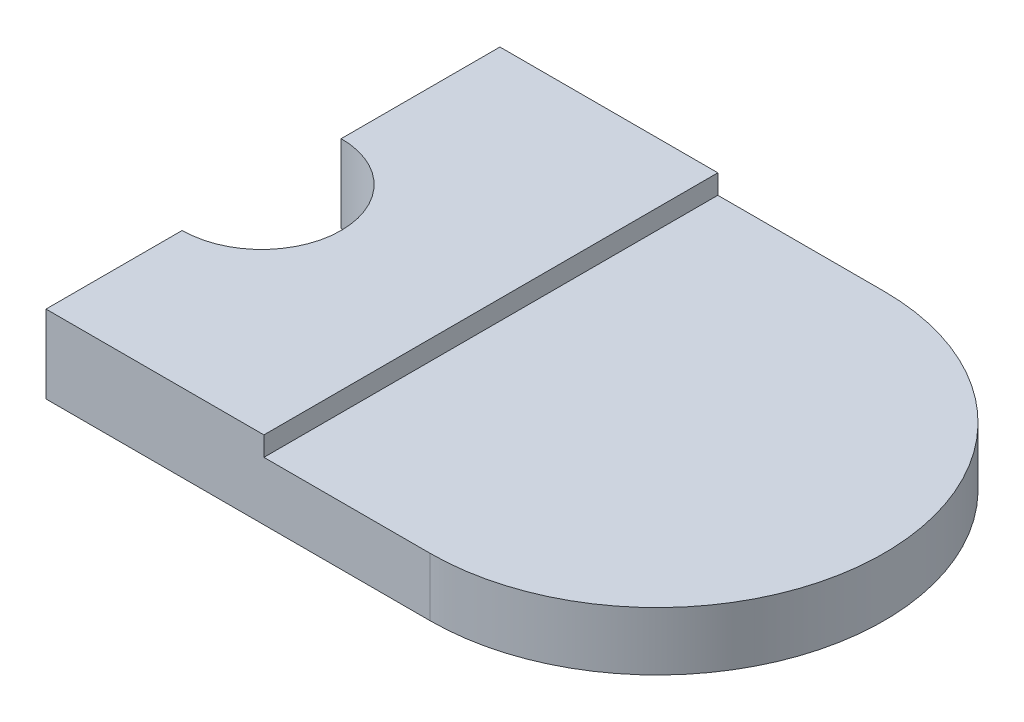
SolidWorks part; units mm, degrees
ref_plane "Front Plane" through (0, 0, 0) normal (0, 0, 1) x (1, 0, 0)
ref_plane "Top Plane" through (0, 0, 0) normal (0, 1, 0) x (1, 0, 0)
ref_plane "Right Plane" through (0, 0, 0) normal (1, 0, 0) x (0, 0, -1)
sketch "Sketch1"
extrude "Extrude1" add sketch "Sketch1" along normal mid plane 25.4
sketch "Sketch3"
extrude "Extrude2" cut sketch "Sketch3" against normal mid plane 6.35
sketch "Sketch5"
extrude "Extrude3" add sketch "Sketch5" against normal blind 55.022
